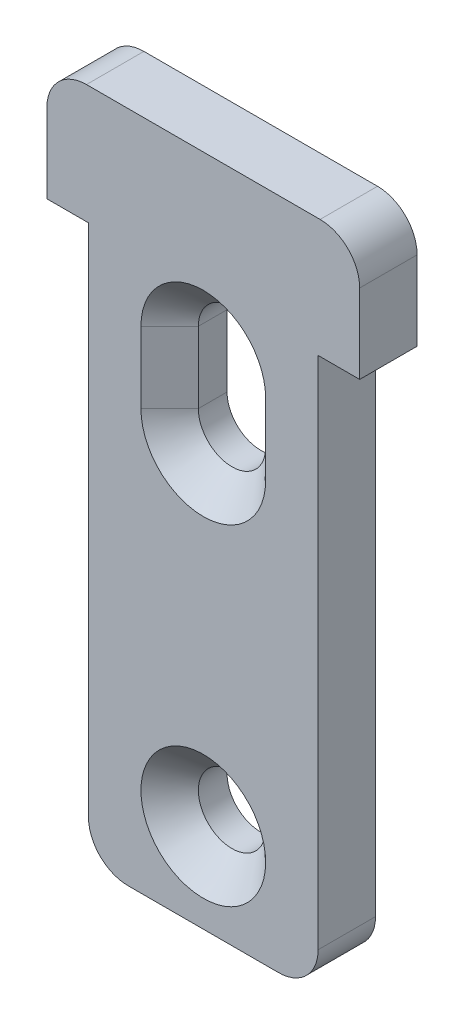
SolidWorks part; units mm, degrees
ref_plane "Plan de face" through (0, 0, 0) normal (0, 0, 1) x (1, 0, 0)
ref_plane "Plan de dessus" through (0, 0, 0) normal (0, 1, 0) x (1, 0, 0)
ref_plane "Plan de droite" through (0, 0, 0) normal (1, 0, 0) x (0, 0, -1)
sketch "Esquisse2" plane through (0, 0, 0) normal (0, 0, 1) x (1, 0, 0)
  line L0 (13.2739, 0) -> (-7.8628, 0) construction
  line L1 (0, 16.2657) -> (0, -11.7535) construction
  line L2 (-7.9, 0) -> (-5.8, 0)
  line L3 (-7.9, 0) -> (-7.9, 4)
  line L4 (-5.9, 6) -> (5.9, 6)
  line L5 (7.9, 0) -> (7.9, 4)
  line L7 (-5.8, 0) -> (-5.8, -26)
  line L8 (-3.8, -28) -> (3.8, -28)
  line L9 (5.8, -26) -> (5.8, 0)
  line L10 (5.8, 0) -> (7.9, 0)
  line L11 (0, -23.5) -> (-19.0002, -23.5) construction
  line L12 (17.4132, -6) -> (-22.8984, -6) construction
  line L16 (0, -8.5971) -> (0, -3.4029) construction
  arc A3 (-5.8, -26) -> (-3.8, -28) centre (-3.8, -26) ccw
  arc A4 (3.8, -28) -> (5.8, -26) centre (3.8, -26) ccw
  arc A5 (5.9, 6) -> (7.9, 4) centre (5.9, 4) cw
  arc A6 (-7.9, 4) -> (-5.9, 6) centre (-5.9, 4) cw
  point P3 (-7.9, 2)
  point P8 (0, 0)
  point P20 (0, -6)
  point P24 (0, -23.5)
  dimension "D6" = 17.5
  dimension "D7" = 2
  dimension "D1" = 15.8
  dimension "D2" = 11.6
  dimension "D3" = 6
  dimension "D4" = 28
  dimension "D5" = 4.5
extrude "Boss.-Extru.1" add sketch "Esquisse2" along normal blind 2.9
sketch "Esquisse23" plane through (0, 0, 0) normal (0, 0, 1) x (1, 0, 0)
  point P0 (0, -5)
  point P1 (0, -23.5)
hole_wizard "Fraisage pour vis à tête fraisée M34" positions "Esquisse24" profile "Esquisse25" countersink size "M3" standard "ISO"
sketch "Esquisse24" plane through (0, 0, 2.9) normal (0, 0, 1) x (1, 0, 0)
  point P0 (0, -23.5)
sketch "Esquisse25" plane through (0, -23.5, 2.9) normal (1, 0, 0) x (0, -1, 0)
  line L0 (0, 0) -> (0, 87.7715)
  line L1 (0, 87.7715) -> (1.7, 86.75)
  line L2 (1.7, 86.75) -> (1.7, 1.45)
  line L3 (1.7, 1.45) -> (3.15, 0)
  line L5 (3.15, 0) -> (0, 0)
  line L6 (-1.7, 1.45) -> (-3.15, 0) construction
  line L10 (0, 87.7715) -> (-1.7, 86.75) construction
  line L11 (0, -6.35) -> (0, 107.95) construction
  dimension "Diamètre du perçage" = 3.4
  dimension "Profondeur du perçage" = 86.75
  dimension "Diamètre du fraisage entrant" = 6.3
  dimension "Angle du fraisage entrant" = 90
  dimension "Angle de pointe" = 118
hole_wizard "Rainure de fraisage pour vis à tête fraisée M38" positions "Esquisse30" profile "Esquisse31" size "M3" standard "ISO"
sketch "Esquisse30" plane through (0, 0, 2.9) normal (0, 0, 1) x (1, 0, 0)
  line L0 (0, -1.5) -> (0, -8.5) construction
  point P0 (0, -5)
  dimension "D1" = 7
sketch "Esquisse31" plane through (0, -5, 2.9) normal (1, 0, 0) x (0, -1, 0)
  line L0 (0, 0) -> (0, 6.0215)
  line L1 (0, 6.0215) -> (1.7, 5)
  line L2 (1.7, 5) -> (1.7, 1.45)
  line L3 (1.7, 1.45) -> (3.15, 0)
  line L5 (3.15, 0) -> (0, 0)
  line L6 (-1.7, 1.45) -> (-3.15, 0) construction
  line L10 (0, 6.0215) -> (-1.7, 5) construction
  line L11 (0, -6.35) -> (0, 107.95) construction
  dimension "Diamètre du perçage" = 3.4
  dimension "Profondeur du perçage" = 5
  dimension "Diamètre du fraisage entrant" = 6.3
  dimension "Angle du fraisage entrant" = 90
  dimension "Angle de pointe" = 118
